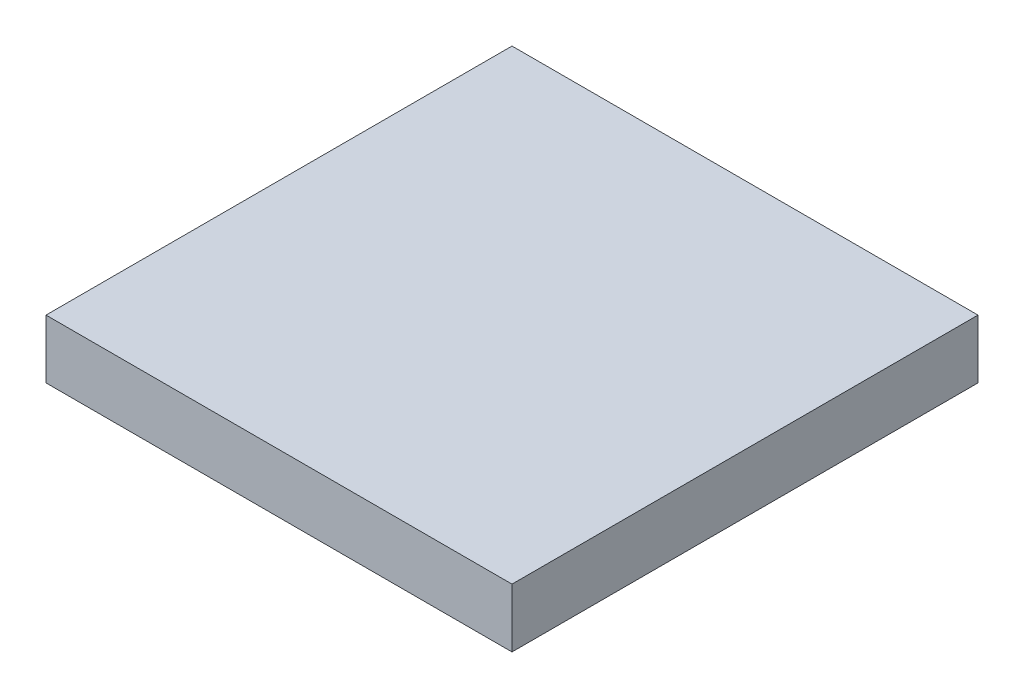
SolidWorks part; units mm, degrees
ref_plane "Ebene vorne" through (0, 0, 0) normal (0, 0, 1) x (1, 0, 0)
ref_plane "Ebene oben" through (0, 0, 0) normal (0, 1, 0) x (1, 0, 0)
ref_plane "Ebene rechts" through (0, 0, 0) normal (1, 0, 0) x (0, 0, -1)
sketch "Skizze1" plane through (0, 0, 0) normal (0, 0, 1) x (1, 0, 0)
  line L1 (0, 0) -> (100, 0)
  line L2 (0, 0) -> (0, 12.609)
  line L3 (0, 12.609) -> (100, 12.609)
  line L4 (100, 0) -> (100, 12.609)
  point P5 (50, 0)
  dimension "D1" = 100
extrude "Linear austragen1" add sketch "Skizze1" along normal mid plane 100
equation "\"LÄNGE\"=0"
equation "\"BREITE\"=0"
equation "\"HÖHE\"=0"
equation "\"DURCHMESSER\"=0"
equation "\"Stückzahl\"= 1"
